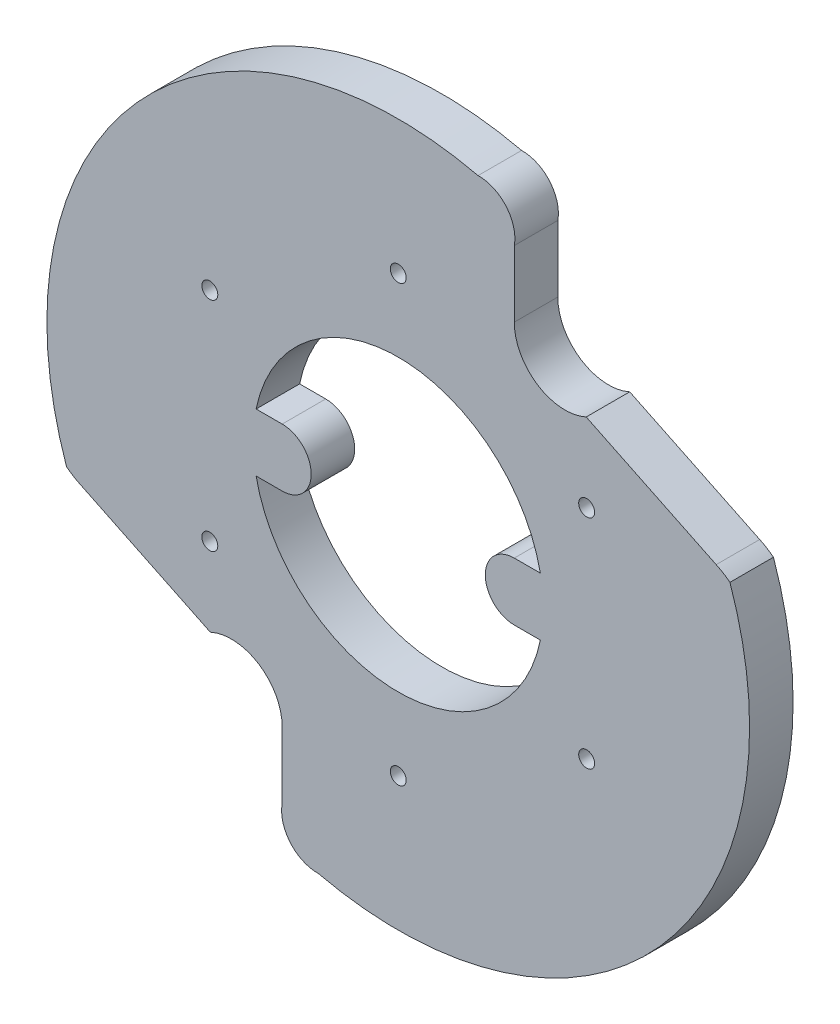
SolidWorks part; units mm, degrees
ref_plane "Plan de face" through (0, 0, 0) normal (0, 0, 1) x (1, 0, 0)
ref_plane "Plan de dessus" through (0, 0, 0) normal (0, 1, 0) x (1, 0, 0)
ref_plane "Plan de droite" through (0, 0, 0) normal (1, 0, 0) x (0, 0, -1)
sketch "Esquisse1" plane through (0, 0, 0) normal (0, 0, 1) x (1, 0, 0)
  line L0 (9.3905, 0) -> (-67.51, 0) construction
  line L1 (25.9128, 25.8036) -> (43.8383, 17.1363)
  line L2 (16, 32.1688) -> (16, 41.3096)
  line L3 (-16, -32.1688) -> (-16, -41.3096)
  line L4 (-25.9128, -25.8036) -> (-43.8383, -17.1363)
  line L5 (0, 32.1688) -> (0, -63.2594) construction
  line L6 (-25.5647, -4) -> (-2.5256, -4) construction
  line L7 (-12, 6.0569) -> (-12, -13.016) construction
  line L8 (-16, 6.0569) -> (-16, -11.6162) construction
  line L9 (-25.5647, 4) -> (-2.5256, 4) construction
  line L10 (-16, 4) -> (-19.5959, 4)
  line L11 (-16, -4) -> (-19.5959, -4)
  line L13 (16, 4) -> (19.5959, 4)
  line L14 (16, -4) -> (19.5959, -4)
  arc A0 (45.7341, 15.9708) -> (48.4425, 0) centre (0, 0) cw
  circle A1 centre (0, 0) radius 30 construction
  arc A2 (43.8383, 17.1363) -> (45.7341, 15.9708) centre (39.5815, 8.0876) cw
  arc A3 (25.9128, 25.8036) -> (16, 32.1688) centre (23, 32.1688) cw
  arc A4 (11.0082, 47.1752) -> (16, 41.3096) centre (11.0938, 42.1911) cw
  arc A5 (-48.4425, 0) -> (11.0082, 47.1752) centre (0, 0) cw
  arc A6 (48.4425, 0) -> (-11.0082, -47.1752) centre (0, 0) cw
  arc A7 (-11.0082, -47.1752) -> (-16, -41.3096) centre (-11.0938, -42.1911) cw
  arc A8 (-25.9128, -25.8036) -> (-16, -32.1688) centre (-23, -32.1688) cw
  arc A9 (-43.8383, -17.1363) -> (-45.7341, -15.9708) centre (-39.5815, -8.0876) cw
  arc A10 (-45.7341, -15.9708) -> (-48.4425, 0) centre (0, 0) cw
  arc A11 (-19.5959, -4) -> (19.5959, -4) centre (0, 0) ccw
  circle A12 centre (0, 30) radius 1.1
  circle A13 centre (25.9808, 15) radius 1.1
  circle A14 centre (25.9808, -15) radius 1.1
  circle A15 centre (0, -30) radius 1.1
  circle A16 centre (-25.9808, -15) radius 1.1
  circle A17 centre (-25.9808, 15) radius 1.1
  arc A18 (-16, -4) -> (-16, 4) centre (-16, 0) ccw
  arc A19 (16, -4) -> (16, 4) centre (16, 0) cw
  arc A20 (19.5959, 4) -> (-19.5959, 4) centre (0, 0) ccw
  dimension "D1" = 2
  dimension "D2" = 6
  dimension "D3" = 4
  dimension "D4" = 8
  dimension "D5" = 4
  dimension "D6" = 12
extrude "Boss.-Extru.1" add sketch "Esquisse1" along normal blind 6
